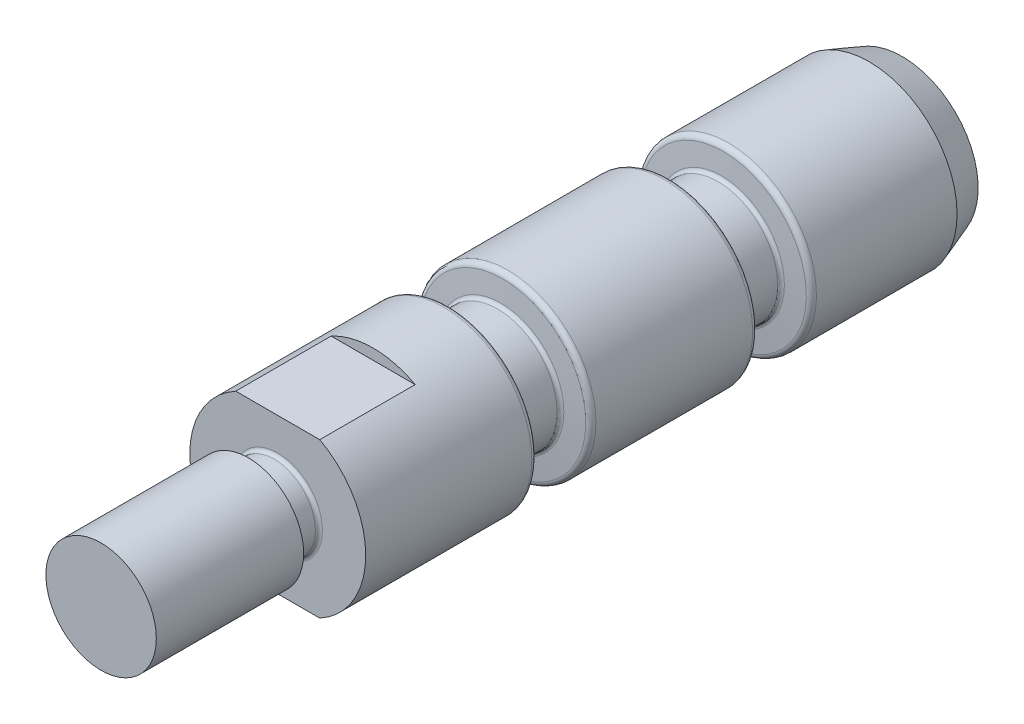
SolidWorks part; units mm, degrees
ref_plane "Front Plane" through (0, 0, 0) normal (0, 0, 1) x (1, 0, 0)
ref_plane "Top Plane" through (0, 0, 0) normal (0, 1, 0) x (1, 0, 0)
ref_plane "Right Plane" through (0, 0, 0) normal (1, 0, 0) x (0, 0, -1)
ref_plane "Plane8" through (0, 82.55, 0) normal (0, 1, 0) x (0, 0, -1)
sketch "Sketch1" plane through (0, 0, 0) normal (0, 0, 1) x (1, 0, 0)
  circle A0 centre (-82.55, 82.55) radius 3.9687
  circle A1 centre (-82.55, 82.55) radius 13.4937 construction
  dimension "D1" = 26.9875
  dimension "D2" = 7.9375
  dimension "D3" = 82.55
  dimension "D4" = 82.55
extrude "Extrude1" add sketch "Sketch1" along normal blind 12.7
sketch "Sketch2" plane through (0, 0, 0) normal (0, 0, -1) x (-1, 0, 0)
  circle A0 centre (82.55, 82.55) radius 6.3246
  dimension "D1" = 12.6492
extrude "Plug" add sketch "Sketch2" along normal blind 44.8945
ref_plane "Plane9" through (-82.55, 0, 0) normal (1, 0, 0) x (0, 0, -1)
sketch "Sketch31" plane through (-82.55, 0, 0) normal (1, 0, 0) x (0, 0, -1)
  line L0 (-12.7, 82.55) -> (-4.9142, 82.55) construction
  line L1 (0, 86.5187) -> (-2.1082, 86.5187)
  line L2 (0, 86.5187) -> (0, 85.7631)
  line L3 (-0.254, 85.5091) -> (-1.8542, 85.5091)
  line L4 (-2.1082, 86.5187) -> (-2.1082, 85.7631)
  line L5 (-12.7, 86.5187) -> (-12.7, 78.5813) construction
  arc A0 (0, 85.7631) -> (-0.254, 85.5091) centre (-0.254, 85.7631) cw
  arc A1 (-1.8542, 85.5091) -> (-2.1082, 85.7631) centre (-1.8542, 85.7631) cw
  dimension "D3" = 0.254
  dimension "D1" = 2.1082
  dimension "D2" = 5.9182
revolve "Cut-Revolve6" cut sketch "Sketch31" angle 360 about L0
ref_plane "Plane1" through (-82.55, 82.55, -42.8625) normal (-1, 0, 0) x (0, -1, 0)
ref_plane "Plane2" through (-82.55, 82.55, -42.8625) normal (-1, 0, 0) x (0, -1, 0)
ref_plane "Plane3" through (-82.55, 82.55, -42.8625) normal (-1, 0, 0) x (0, -1, 0)
ref_plane "Plane4" through (-82.55, 82.55, -42.8625) normal (-1, 0, 0) x (0, -1, 0)
sketch "Sketch25" plane through (-82.55, 82.55, -42.8625) normal (-1, 0, 0) x (0, -1, 0)
  line L0 (4.5245, 14.5405) -> (6.3957, 14.7042)
  line L1 (6.3957, 14.7042) -> (6.3957, 10.8005)
  line L2 (6.3957, 10.8005) -> (4.5245, 10.9642)
  line L3 (4.2926, 11.2173) -> (4.2926, 14.2875)
  line L4 (0, 50) -> (0, -50) construction
  line L6 (4.5245, 10.9642) -> (4.2926, 10.9845) construction
  line L7 (4.5245, 14.5405) -> (4.2926, 14.5405) construction
  line L8 (4.2926, 14.2875) -> (4.2926, 14.5405) construction
  line L9 (4.2926, 11.2173) -> (4.2926, 10.9845) construction
  line L10 (0, -2.032) -> (0, 42.8625) construction
  line L11 (6.3246, 42.8625) -> (-6.3246, 42.8625) construction
  arc A0 (4.5245, 10.9642) -> (4.2926, 11.2173) centre (4.5466, 11.2173) cw
  arc A1 (4.2926, 14.2875) -> (4.5245, 14.5405) centre (4.5466, 14.2875) cw
  dimension "D6" = 0.254
  dimension "D7" = 0.254
  dimension "D1" = 28.575
  dimension "D2" = 8.5852
  dimension "D3" = 3.556
  dimension "D4" = 95
  dimension "D5" = 95
ref_plane "Plane5" through (-82.55, 82.55, -42.8625) normal (-1, 0, 0) x (0, -1, 0)
sketch "Sketch27" plane through (-82.55, 82.55, -42.8625) normal (-1, 0, 0) x (0, -1, 0)
  line L0 (4.5245, 30.4155) -> (6.798, 30.6144)
  line L1 (6.798, 30.6144) -> (6.7629, 26.6231)
  line L2 (6.7629, 26.6231) -> (4.5245, 26.819)
  line L3 (4.2926, 27.072) -> (4.2926, 30.1625)
  line L4 (0, 50) -> (0, -50) construction
  line L6 (4.5245, 26.819) -> (4.2926, 26.8392) construction
  line L7 (4.2926, 27.072) -> (4.2926, 26.8392) construction
  line L8 (4.2926, 30.1625) -> (4.2926, 30.3952) construction
  line L9 (4.5245, 30.4155) -> (4.2926, 30.3952) construction
  line L10 (0, -2.032) -> (0, 42.8625) construction
  line L11 (6.3246, 42.8625) -> (-6.3246, 42.8625) construction
  arc A0 (4.5245, 26.819) -> (4.2926, 27.072) centre (4.5466, 27.072) cw
  arc A1 (4.2926, 30.1625) -> (4.5245, 30.4155) centre (4.5466, 30.1625) cw
  dimension "D5" = 0.254
  dimension "D6" = 0.254
  dimension "D1" = 12.7
  dimension "D2" = 3.556
  dimension "D3" = 8.5852
  dimension "D4" = 95
  dimension "D7" = 95
ref_plane "Plane6" through (-82.55, 82.55, 936.625) normal (-1, 0, 0) x (0, 1, 0)
ref_plane "Plane7" through (-82.55, 82.55, 936.625) normal (-1, 0, 0) x (0, 1, 0)
revolve "#2-109" cut sketch "Sketch25" angle 360 about L4
revolve "Cut-Revolve2" cut sketch "Sketch27" angle 360 about L4
hole_wizard "1/4-20 Tapped Hole1" positions "Sketch29" profile "Sketch28" tap size "1/4-20" standard "ANSI Inch"
sketch "Sketch29" plane through (0, 0, -44.8945) normal (0, 0, -1) x (-1, 0, 0)
  point P0 (82.55, 82.55)
sketch "Sketch28" plane through (-82.55, 82.55, -44.8945) normal (1, 0, 0) x (0, 1, 0)
  line L0 (0, 0) -> (0, 13.3551)
  line L1 (0, 13.3551) -> (2.6543, 11.7602)
  line L2 (2.6543, 11.7602) -> (2.6543, 0)
  line L5 (2.6543, 0) -> (0, 0)
  line L10 (0, 13.3551) -> (-2.6543, 11.7602) construction
  line L11 (0, -6.35) -> (0, 107.95) construction
  dimension "Tap Drill Dia." = 5.3086
  dimension "Tap Drill Depth" = 11.7602
  dimension "Drill Angle" = 118
sketch "Sketch32" plane through (-82.55, 0, 0) normal (1, 0, 0) x (0, 0, -1)
  line L0 (-12.7, 82.55) -> (-4.1611, 82.55) construction
  line L1 (0, 91.5673) -> (6.858, 91.5673)
  line L2 (0, 91.5673) -> (0, 88.1063)
  line L3 (0, 88.1063) -> (6.858, 88.1063)
  line L4 (6.858, 91.5673) -> (6.858, 88.1063)
  line L5 (0, 74.6079) -> (6.858, 74.6079)
  line L6 (0, 74.6079) -> (0, 76.9938)
  line L7 (0, 76.9938) -> (6.858, 76.9938)
  line L8 (6.858, 74.6079) -> (6.858, 76.9938)
  line L9 (-12.7, 86.5187) -> (-12.7, 78.5813) construction
  line L10 (0, 88.8746) -> (0, 76.2254) construction
  dimension "D1" = 5.5562
  dimension "D2" = 11.1125
  dimension "D3" = 6.858
extrude "Cut-Extrude1" cut sketch "Sketch32" against normal through all and the other way through all
chamfer "Chamfer1" distance 2.3812 angle 20 1 edges at (-88.8746, 82.55, -44.8945)
fillet "Fillet1" radius 0.381 1 edges at (-82.55, 88.8746, -16.201)
fillet "Fillet2" radius 0.381 1 edges at (-82.55, 88.8746, -32.0557)
fillet "Fillet3" radius 0.381 1 edges at (-82.55, 76.2254, -12.2895)
fillet "Fillet4" radius 0.381 1 edges at (-82.55, 76.2254, -28.1645)
